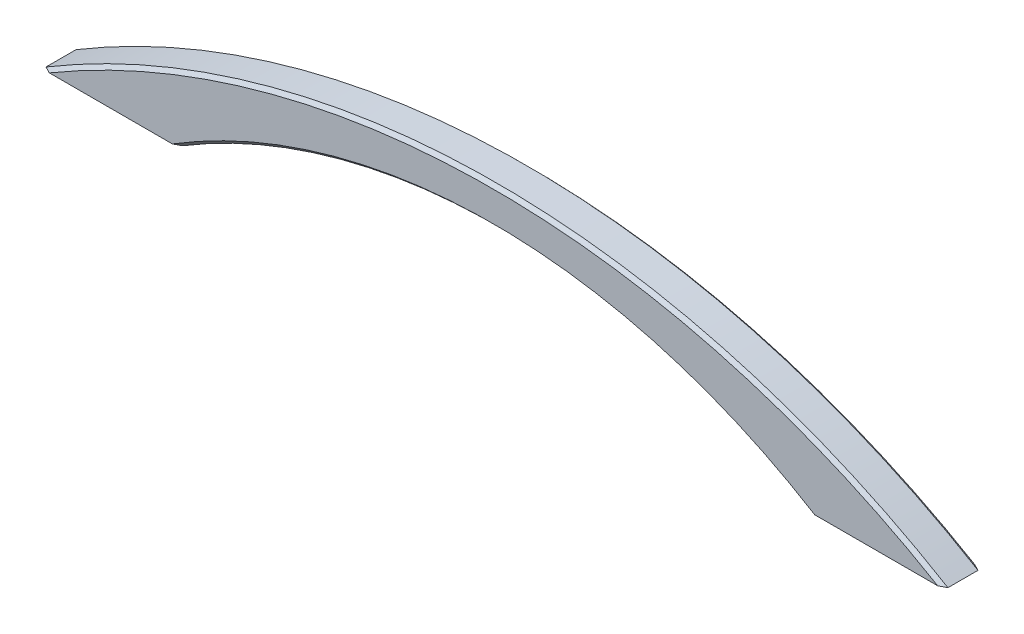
SolidWorks part; units mm, degrees
ref_plane "正面" through (0, 0, 0) normal (0, 0, 1) x (1, 0, 0)
ref_plane "平面" through (0, 0, 0) normal (0, 1, 0) x (1, 0, 0)
ref_plane "右側面" through (0, 0, 0) normal (1, 0, 0) x (0, 0, -1)
sketch "ｽｹｯﾁ1" plane through (0, 0, 0) normal (0, 0, 1) x (1, 0, 0)
  line L0 (-68, 0) -> (-97.5, 0)
  line L1 (97.5, 0) -> (68, 0)
  line L2 (0, 0) -> (0, 70.3267) construction
  arc A0 (-97.5, 0) -> (97.5, 0) centre (0, -162.5417) cw
  arc A1 (-68, 0) -> (68, 0) centre (0, -112.1842) cw
  dimension "D3" = 8
  dimension "D4" = 27
  dimension "D1" = 195
  dimension "D2" = 136
extrude "ﾎﾞｽ - 押し出し1" add sketch "ｽｹｯﾁ1" along normal mid plane 8
hole_wizard "M4x0.7 ねじ穴1" positions "ｽｹｯﾁ2" profile "ｽｹｯﾁ3" tap size "M4x0.7" standard "Ansi Metric"
sketch "ｽｹｯﾁ2" plane through (0, 0, 0) normal (0, -1, 0) x (-1, 0, 0)
  line L0 (75, 0) -> (-75, 0) construction
  point P0 (75, 0)
  point P2 (-75, 0)
  dimension "D1" = 150
sketch "ｽｹｯﾁ3" plane through (-75, 0, 0) normal (1, 0, 0) x (0, 0, -1)
  line L0 (0, 0) -> (0, 6.9914)
  line L1 (0, 6.9914) -> (1.65, 6)
  line L2 (1.65, 6) -> (1.65, 0)
  line L5 (1.65, 0) -> (0, 0)
  line L10 (0, 6.9914) -> (-1.65, 6) construction
  line L11 (0, -6.35) -> (0, 107.95) construction
  dimension "ねじ下穴ﾄﾞﾘﾙ直径" = 3.3
  dimension "ねじ下穴ﾄﾞﾘﾙの深さ" = 6
  dimension "ﾄﾞﾘﾙ角度" = 118
chamfer "面取り1" distance 0.75 angle 45 4 edges at (0, 27, -4) (0, 27, 4) (0, 19, -4) (0, 19, 4)
